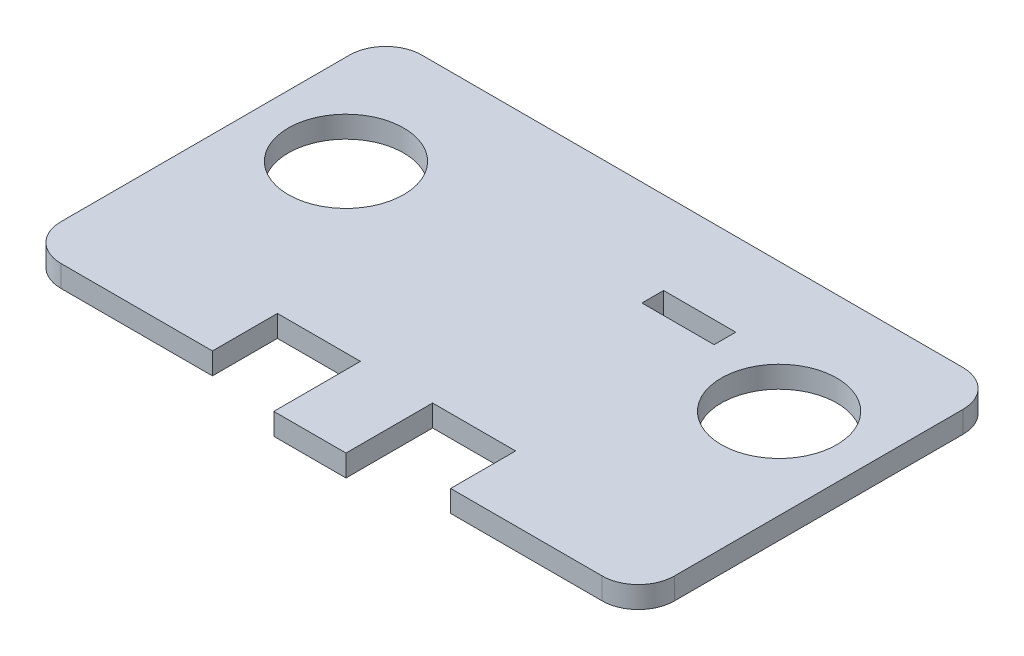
SolidWorks part; units mm, degrees
ref_plane "Front Plane" through (0, 0, 0) normal (0, 0, 1) x (1, 0, 0)
ref_plane "Top Plane" through (0, 0, 0) normal (0, 1, 0) x (1, 0, 0)
ref_plane "Right Plane" through (0, 0, 0) normal (1, 0, 0) x (0, 0, -1)
sketch "Sketch1" plane through (0, 0, 0) normal (0, 1, 0) x (1, 0, 0)
  line L1 (-42.5, 25) -> (42.5, 25)
  line L2 (-42.5, 25) -> (-42.5, -25)
  line L3 (-42.5, -25) -> (42.5, -25)
  line L4 (42.5, 25) -> (42.5, -25)
  line L5 (-42.5, 25) -> (42.5, -25) construction
  line L6 (-42.5, -25) -> (42.5, 25) construction
  point P0 (0, 0)
  dimension "D1" = 85
  dimension "D2" = 50
extrude "Boss-Extrude1" add sketch "Sketch1" along normal blind 3
fillet "Fillet1" radius 5 4 edges at (-42.5, 1.5, -25) (42.5, 1.5, -25) (42.5, 1.5, 25) (-42.5, 1.5, 25)
sketch "Sketch2" plane through (0, 3, 0) normal (0, 1, 0) x (1, 0, 0)
  line L1 (-30, 7) -> (30, 7) construction
  line L2 (37.5, 25) -> (-37.5, 25) construction
  line L3 (0, -1.65) -> (0, 1.65) construction
  circle A0 centre (-30, 7) radius 8
  circle A1 centre (30, 7) radius 8
  dimension "D4" = 16
  dimension "D1" = 18
  dimension "D2" = 30
  dimension "D3" = 30
extrude "Cut-Extrude1" cut sketch "Sketch2" against normal blind 3
sketch "Sketch4" plane through (0, 3, 0) normal (0, 1, 0) x (1, 0, 0)
  line L0 (-37.5, -25) -> (37.5, -25) construction
  line L1 (0, -25) -> (-16.5, -25)
  line L2 (0, -25) -> (0, -16)
  line L3 (0, -16) -> (-16.5, -16)
  line L4 (-16.5, -25) -> (-16.5, -16)
  dimension "D1" = 9
  dimension "D2" = 16.5
extrude "Cut-Extrude2" cut sketch "Sketch4" against normal blind 3
mirror "Mirror1" about plane through (0, 0, 0) normal (1, 0, 0) of "Cut-Extrude2"
sketch "Sketch6" plane through (0, 3, 0) normal (0, 1, 0) x (1, 0, 0)
  line L0 (16.5, -16) -> (-16.5, -16) construction
  line L1 (-5, -16) -> (5, -16)
  line L2 (-5, -16) -> (-5, -28)
  line L3 (-5, -28) -> (5, -28)
  line L4 (5, -16) -> (5, -28)
  line L5 (0, -1.65) -> (0, 1.65) construction
  dimension "D1" = 10
  dimension "D2" = 12
  dimension "D3" = 5
extrude "Boss-Extrude2" add sketch "Sketch6" against normal blind 3 contours L2 L3 L4 L1
sketch "Sketch7" plane through (0, 3, 0) normal (0, 1, 0) x (1, 0, 0)
  line L0 (42.5, -20) -> (42.5, 20) construction
  line L1 (7.5, 13.5) -> (17.5, 13.5)
  line L2 (7.5, 13.5) -> (7.5, 10.5)
  line L3 (7.5, 10.5) -> (17.5, 10.5)
  line L4 (17.5, 13.5) -> (17.5, 10.5)
  line L5 (7.5, 13.5) -> (17.5, 10.5) construction
  line L6 (7.5, 10.5) -> (17.5, 13.5) construction
  line L7 (37.5, 25) -> (-37.5, 25) construction
  point P0 (12.5, 12)
  dimension "D1" = 30
  dimension "D2" = 13
  dimension "D3" = 10
  dimension "D4" = 3
extrude "Cut-Extrude3" cut sketch "Sketch7" against normal blind 3
